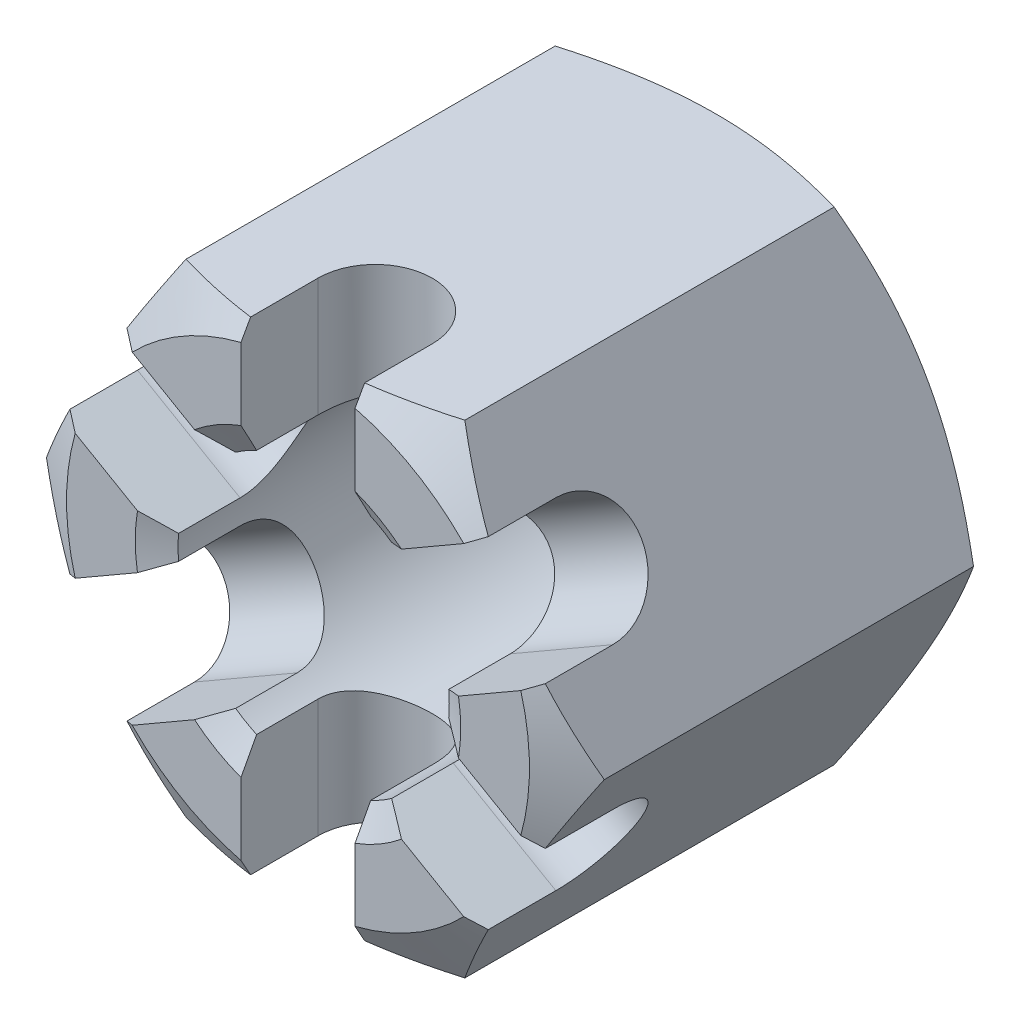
SolidWorks part; units mm, degrees
ref_plane "Front" through (0, 0, 0) normal (0, 0, 1) x (1, 0, 0)
ref_plane "Top" through (0, 0, 0) normal (0, 1, 0) x (1, 0, 0)
ref_plane "Right" through (0, 0, 0) normal (1, 0, 0) x (0, 0, -1)
sketch "Sketch1" plane through (0, 0, 0) normal (0, 0, 1) x (1, 0, 0)
  line L1 (5.1962, -9) -> (10.3923, 0)
  line L2 (10.3923, 0) -> (5.1962, 9)
  line L3 (5.1962, 9) -> (-5.1962, 9)
  line L4 (-5.1962, 9) -> (-10.3923, 0)
  line L5 (-10.3923, 0) -> (-5.1962, -9)
  line L6 (-5.1962, -9) -> (5.1962, -9)
  circle A0 centre (0, 0) radius 9 construction
  circle A1 centre (0, 0) radius 5.053
  dimension "D" = 10.106
  dimension "s" = 18
extrude "BaseNut" add sketch "Sketch1" against normal blind 15.8
sketch "Sketch2" plane through (0, 0, 0) normal (0, 1, 0) x (1, 0, 0)
  line L0 (-10.3923, 15.8) -> (-8.625, 15.8)
  line L2 (-8.625, 15.8) -> (-10.3923, 14.7796)
  line L3 (-10.3923, 14.7796) -> (-10.3923, 15.8)
  line L4 (0, 3.3759) -> (0, -9.8171) construction
  line L6 (-9.7712, 7.9) -> (9.8853, 7.9) construction
  line L7 (-10.3923, 1.0204) -> (-10.3923, 0)
  line L8 (-8.625, 0) -> (-10.3923, 1.0204)
  line L9 (-10.3923, 0) -> (-8.625, 0)
  dimension "D1" = 30
  dimension "dw" = 17.25
  dimension "D2" = 7.9
revolve "Double-Chamfer" cut sketch "Sketch2" angle 360 about L4
chamfer "EndChamfer" distance 1.0106 angle 30 2 edges at (5.053, 0, -15.8) (5.053, 0, 0)
sketch "Sketch3" plane through (0, 0, 0) normal (0, 1, 0) x (1, 0, 0)
  line L0 (0, 4.2201) -> (0, -10.5237) construction
  line L2 (-2.125, 0) -> (-2.125, 2.875)
  line L3 (2.125, 0) -> (2.125, 2.875)
  line L4 (5.6365, 15.8) -> (-5.6365, 15.8) construction
  arc A0 (-2.125, 2.875) -> (2.125, 2.875) centre (0, 2.875) cw
  point P2 (0, 5)
  point P3 (0, 15.8)
  dimension "D1" = 5
  dimension "W" = 10.8
  dimension "n" = 4.25
extrude "Slot" cut sketch "Sketch3" against normal through all and the other way through all
pattern_circular "SlotPattern" count 3 over 360 about axis through (0, 0, -3.3759) along (0, 0, 1) of "Slot"
sketch "Sketch4" plane through (0, 0, 0) normal (0, 1, 0) x (1, 0, 0)
  line L0 (8.625, 0) -> (8.625, 5)
  line L2 (8.625, 5) -> (10.3923, 6.0204)
  line L4 (8.625, 0) -> (10.3923, 0)
  line L5 (10.3923, 0) -> (10.3923, 6.0204)
  line L7 (0, -0.375) -> (0, -8.8366) construction
  line L19 (8.3017, 0) -> (8.625, 0) construction
  line L20 (10.3923, 14.7796) -> (10.3923, 1.0204) construction
  dimension "D1" = 30
  dimension "W" = 10.8
  dimension "de" = 17.25
revolve "Cut-Revolve1" [suppressed] cut sketch "Sketch4" angle 360 about L7
sketch "Sketch5" plane through (0, 0, 0) normal (0, 1, 0) x (1, 0, 0)
  line L0 (0, 8.5981) -> (0, -0.494) construction
  line L1 (-5.053, 16.2735) -> (-5.8731, 15.8)
  line L2 (-5.8731, 15.8) -> (-5.053, 15.3265)
  line L3 (-5.053, 15.3265) -> (-4.106, 15.3265)
  line L4 (-4.106, 15.3265) -> (-4.106, 16.2735)
  line L5 (-4.106, 16.2735) -> (-5.053, 16.2735)
  dimension "D1" = 0.947
  dimension "D2" = 10.106
revolve "Cut-Revolve10" [suppressed] cut sketch "Sketch5" angle 360 about L0
pattern_linear "LPattern10" [suppressed] count 14 spacing 1.1364 along (0, 0, 1)
equation "\"dw@Sketch2\" = \"s@Sketch1\"-0.75"
equation "\"de@Sketch4\" = \"dw@Sketch2\""
equation "\"D1@Sketch3\" = \"m@BaseNut\" - \"W@Sketch3\""
equation "\"D2@Sketch2\" = \"m@BaseNut\" / 2"
equation "\"W@Sketch4\" = \"W@Sketch3\""
equation "\"D2@Sketch5\"=\"D@Sketch1\""
equation "\"D1@Sketch5\"= ( \"D@ThreadCosmetic1\"-\"D2@Sketch5\" )  / 2"
equation "\"D3@LPattern10\" = \"D1@Sketch5\" * 1.2"
equation "\"D1@LPattern10\" = \"m@BaseNut\" / \"D3@LPattern10\""
equation "\"D1@EndChamfer\"=\"D@Sketch1\" / 10"
